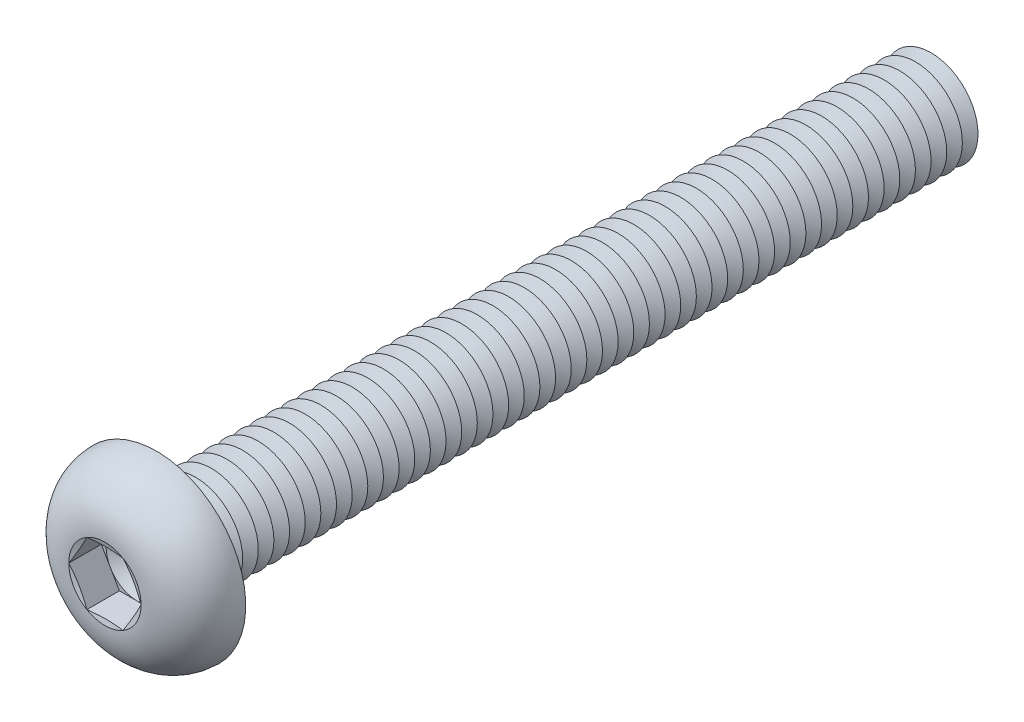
SolidWorks part; units mm, degrees
ref_plane "Front Plane" through (0, 0, 0) normal (0, 0, 1) x (1, 0, 0)
ref_plane "Top Plane" through (0, 0, 0) normal (0, 1, 0) x (1, 0, 0)
ref_plane "Right Plane" through (0, 0, 0) normal (1, 0, 0) x (0, 0, -1)
sketch "Sketch1" plane through (0, 0, 0) normal (1, 0, 0) x (0, 0, -1)
  line L0 (0, 1.5) -> (0, 2.85)
  line L3 (0, 1.5) -> (25, 1.5)
  line L4 (25, 1.5) -> (25, 0)
  line L5 (25, 0) -> (-1.65, 0) construction
  line L6 (-1.65, 0) -> (25, 0)
  line L7 (-1.65, 1.1547) -> (-1.65, 0.5773) construction
  line L8 (-1.65, 0.5773) -> (-1.65, 0)
  line L9 (-1.65, 1.1547) -> (-1.4953, 0.5773)
  line L10 (-1.4953, 0.5773) -> (-1.65, 0.5773)
  line L11 (25, 0) -> (22.7481, 0) construction
  line L12 (0, 2.85) -> (-1.65, 2.85) construction
  arc A1 (0, 2.85) -> (-1.65, 1.1547) centre (0, 1.1994) ccw
  point P8 (25, 0.75)
  dimension "D1" = 5.7
  dimension "D2" = 3
  dimension "D3" = 1.65
  dimension "D4" = 2.3094
  dimension "D5" = 25
  dimension "D6" = 15
revolve "Revolve1" add sketch "Sketch1" angle 360 about L5
fillet "Fillet1" radius 0.25 1 edges at (-1.5, 0, 0)
sketch "Sketch2" plane through (0, 0, 0) normal (1, 0, 0) x (0, 0, -1)
  line L0 (24.75, 1.5) -> (25.25, 1.5)
  line L1 (25, 1.5) -> (0.25, 1.5) construction
  line L2 (25.25, 1.5) -> (25, 1.067)
  line L3 (25, -1.5) -> (25, 1.5) construction
  line L4 (25, 1.067) -> (24.75, 1.5)
  dimension "D1" = 0.5
revolve "Cut-Revolve1" cut sketch "Sketch2" angle 360 about axis through (0, 0, -25) along (0, 0, -1)
pattern_linear "LPattern1" count 50 spacing 0.5 along (0, 0, 1) of "Cut-Revolve1"
sketch "Sketch3" plane through (0, 0, 1.65) normal (0, 0, 1) x (1, 0, 0)
  line L7 (0.5773, 1) -> (-0.5774, 1)
  line L8 (-0.5774, 1) -> (-1.1547, 0)
  line L9 (-1.1547, 0) -> (-0.5773, -1)
  line L10 (-0.5773, -1) -> (0.5773, -1)
  line L11 (0.5773, -1) -> (1.1547, 0)
  line L12 (1.1547, 0) -> (0.5773, 1)
  circle A0 centre (0, 0) radius 1 construction
  circle A3 centre (0, 0) radius 1.1547 construction
extrude "Cut-Extrude1" cut sketch "Sketch3" against normal blind 1.04
sketch "Sketch4" plane through (0, 0, 0.61) normal (0, 0, 1) x (1, 0, 0)
  line L1 (0.5773, 1) -> (-0.5774, 1) construction
  circle A0 centre (0, 0) radius 1
extrude "Cut-Extrude2" cut sketch "Sketch4" against normal through all draft 60
